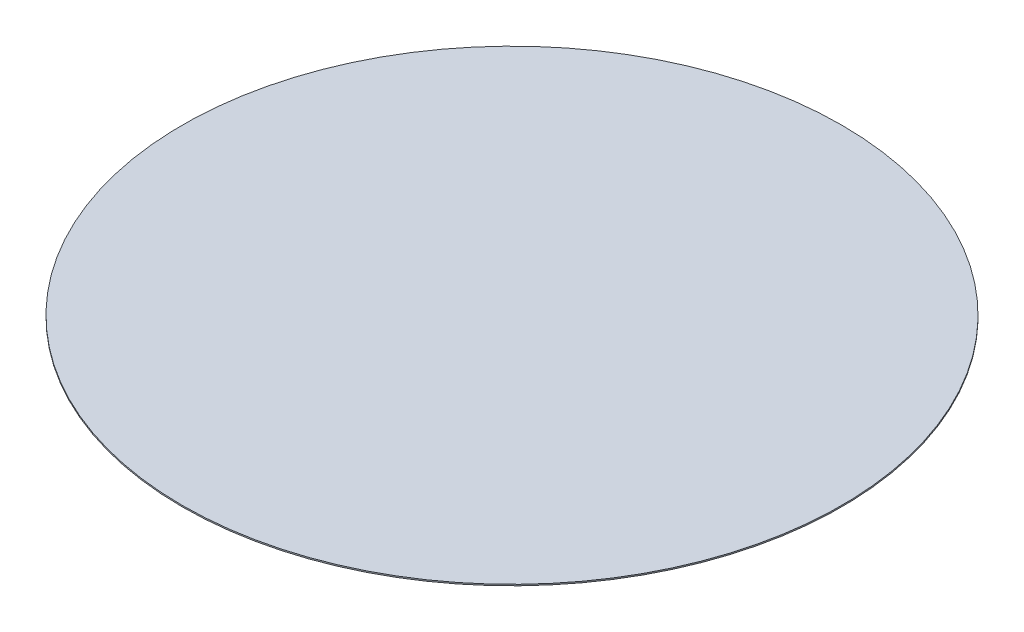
SolidWorks part; units mm, degrees
ref_plane "Front Plane" through (0, 0, 0) normal (0, 0, 1) x (1, 0, 0)
ref_plane "Top Plane" through (0, 0, 0) normal (0, 1, 0) x (1, 0, 0)
ref_plane "Right Plane" through (0, 0, 0) normal (1, 0, 0) x (0, 0, -1)
sketch "Sketch1" plane through (0, 0, 0) normal (0, 1, 0) x (1, 0, 0)
  circle A0 centre (0, 0) radius 50
  dimension "D1" = 100
extrude "Boss-Extrude1" add sketch "Sketch1" against normal blind 0.2
